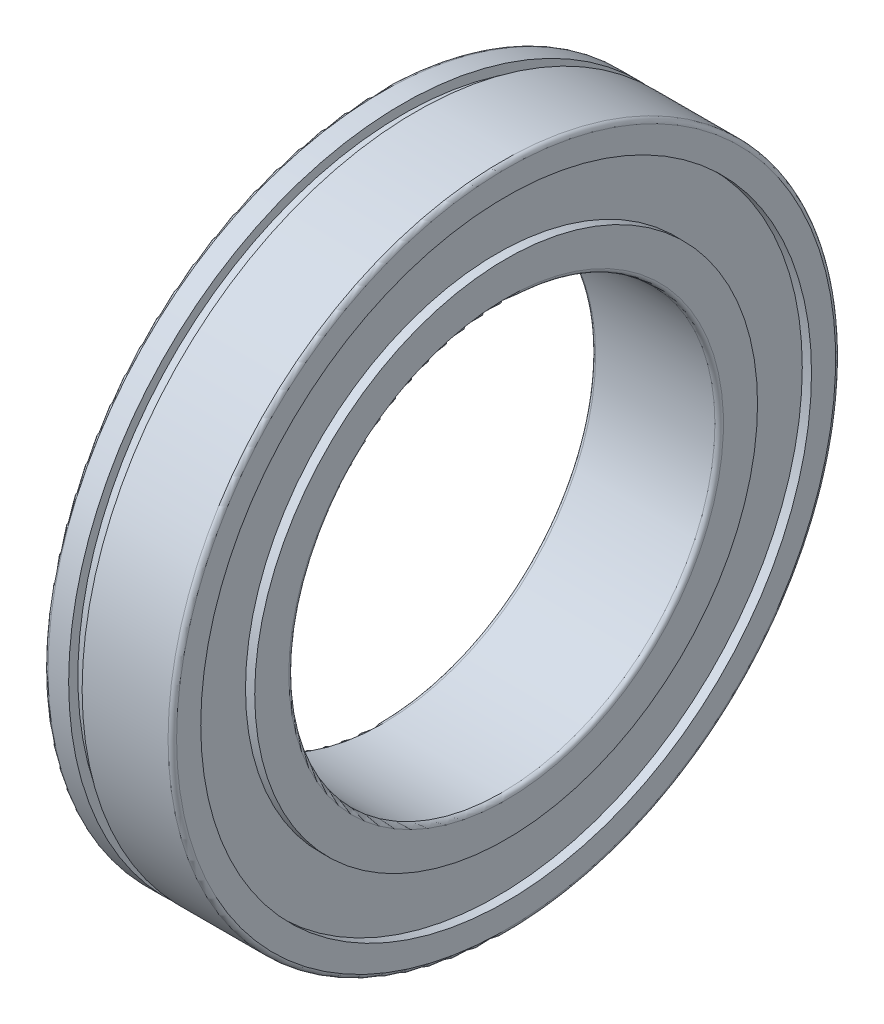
SolidWorks part; units mm, degrees
ref_plane "Front X-Y" through (0, 0, 0) normal (0, 0, 1) x (1, 0, 0)
ref_plane "Top X-Z" through (0, 0, 0) normal (0, 1, 0) x (1, 0, 0)
ref_plane "Right Y-Z" through (0, 0, 0) normal (1, 0, 0) x (0, 0, -1)
ref_plane "Plane1" through (0, 0, 0) normal (0, 0, 1) x (1, 0, 0)
sketch "Sketch1" plane through (0, 0, 0) normal (0, 0, 1) x (1, 0, 0)
  line L0 (0, 23.25) -> (0, 21.5)
  line L1 (0, 21.5) -> (0.65, 21.5)
  line L2 (0.65, 21.5) -> (0.65, 17.7)
  line L3 (0.65, 17.7) -> (0, 17.7)
  line L4 (0, 17.7) -> (0, 15.3)
  line L5 (0.3, 15) -> (8.7, 15)
  line L6 (9, 15.3) -> (9, 17.7)
  line L7 (9, 17.7) -> (8.35, 17.7)
  line L8 (8.35, 17.7) -> (8.35, 21.5)
  line L9 (8.35, 21.5) -> (9, 21.5)
  line L10 (9, 21.5) -> (9, 23.2)
  line L11 (8.7, 23.5) -> (0.25, 23.5)
  line L12 (9, 0) -> (0, 0) construction
  arc A0 (0, 15.3) -> (0.3, 15) centre (0.3, 15.3) ccw
  arc A1 (8.7, 15) -> (9, 15.3) centre (8.7, 15.3) ccw
  arc A2 (9, 23.2) -> (8.7, 23.5) centre (8.7, 23.2) ccw
  arc A3 (0.25, 23.5) -> (0, 23.25) centre (0.25, 23.25) ccw
revolve "Revolve1" add sketch "Sketch1" angle 360 about L12
ref_plane "Plane2" through (0, 0, 0) normal (0, 0, 1) x (1, 0, 0)
sketch "Sketch2" plane through (0, 0, 0) normal (0, 0, 1) x (1, 0, 0)
  line L0 (1.7, 22.85) -> (2.65, 22.85)
  line L1 (2.65, 22.85) -> (2.65, 27.85)
  line L2 (2.65, 27.85) -> (1.7, 27.85)
  line L3 (1.7, 27.85) -> (1.7, 22.85)
  line L4 (2.65, 0) -> (1.7, 0) construction
revolve "Cut-Revolve1" cut sketch "Sketch2" angle 360 about L4
